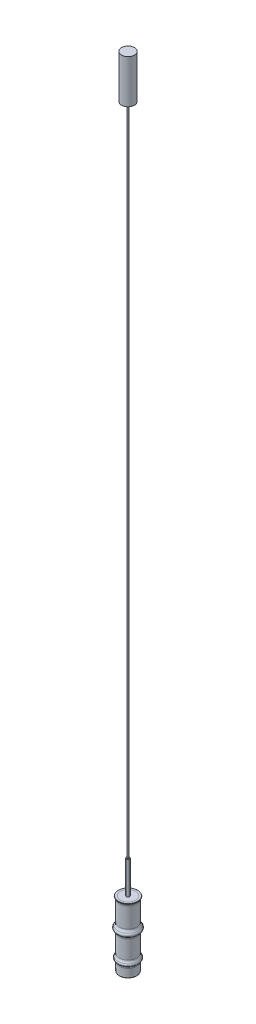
SolidWorks part; units mm, degrees
ref_plane "Alzado" through (0, 0, 0) normal (0, 0, 1) x (1, 0, 0)
ref_plane "Planta" through (0, 0, 0) normal (0, 1, 0) x (1, 0, 0)
ref_plane "Vista lateral" through (0, 0, 0) normal (1, 0, 0) x (0, 0, -1)
other "Centro de masa"
sketch "Croquis2" plane through (0, 0, 0) normal (0, 1, 0) x (1, 0, 0)
  circle A0 centre (0, 0) radius 125
  dimension "D1" = 250
extrude "Saliente-Extruir1" add sketch "Croquis2" along normal blind 10
sketch "Croquis5" plane through (0, 10, 0) normal (0, 1, 0) x (1, 0, 0)
  circle A0 centre (0, 0) radius 7
  dimension "D1" = 14
extrude "Saliente-Extruir3" add sketch "Croquis5" along normal blind 20 separate body
sketch "Croquis6" plane through (0, 0, 0) normal (0, 0, 1) x (1, 0, 0)
  line L0 (7, 30) -> (-7, 30) construction
  line L1 (-100, 393) -> (100, 393) construction
  line L2 (-100, 393) -> (-100, 130)
  line L3 (-100, 130) -> (100, 130) construction
  line L5 (-100, 393) -> (100, 130) construction
  line L6 (-100, 130) -> (100, 393) construction
  line L7 (390.346, 493) -> (-264.1076, 493) construction
  line L8 (0, 0) -> (0, 854.3075) construction
  line L9 (-125, 0) -> (125, 0) construction
  line L10 (259.6636, 401.5) -> (-247.4579, 401.5) construction
  line L12 (-247.4579, 121.5) -> (259.6636, 121.5) construction
  arc A0 (100, 393) -> (-100, 393) centre (0, 393) ccw
  arc A1 (100, 130) -> (-100, 130) centre (0, 130) cw
  point P0 (0, 261.5)
  dimension "D1" = 200
  dimension "D2" = 493
  dimension "D3" = 140
  dimension "D4" = 140
sweep "Barrer1" add path "Croquis6" parameters "D3"=14
sketch "Croquis3" plane through (0, 0, 0) normal (0, 0, 1) x (1, 0, 0)
  line L0 (100, 130) -> (100, 393) construction
  line L5 (140, 111.5) -> (140, 411.5) construction
  line L7 (140, 406.5) -> (140, 296.5)
  line L8 (140, 276.5) -> (140, 174)
  line L9 (140, 159) -> (140, 111.5)
  line L12 (135, 411.5) -> (135, 111.5)
  line L13 (135, 111.5) -> (140, 111.5) construction
  line L14 (135, 111.5) -> (140, 111.5)
  line L15 (135, 411.5) -> (145, 411.5)
  line L16 (135, 411.5) -> (140, 411.5) construction
  line L18 (100, 261.5) -> (305.5788, 261.5) construction
  line L20 (107, 130) -> (93, 130) construction
  line L21 (93, 393) -> (107, 393) construction
  arc A0 (140, 406.5) -> (145, 411.5) centre (140, 411.5) ccw
  arc A1 (140, 276.5) -> (140, 296.5) centre (140, 286.5) ccw
  arc A2 (140, 159) -> (140, 174) centre (140, 166.5) ccw
  point P13 (135, 261.5)
  point P21 (140, 225.25)
  dimension "D5" = 10
  dimension "D6" = 20
  dimension "D7" = 15
  dimension "D2" = 40
  dimension "D3" = 55
  dimension "D4" = 120
  dimension "D9" = 5
  dimension "D10" = 300
revolve "Revolución1" add sketch "Croquis3" angle 360 about L0
sketch "Croquis21" plane through (0, 393, 0) normal (0, -1, 0) x (-1, 0, 0)
  circle A0 centre (-100, 0) radius 30
  circle A1 centre (-100, 0) radius 7 construction
  dimension "D1" = 60
extrude "Saliente-Extruir4" add sketch "Croquis21" along normal up to surface (263 mm away) separate body
fillet "Redondeo1" radius 15 5 edges at (100, 159, -40) (100, 174, -40) (100, 276.5, -40) (100, 296.5, -40) (100, 406.5, -40)
fillet "Redondeo2" radius 1 2 edges at (100, 411.5, -45) (100, 111.5, -40)
delete or keep bodies "Sólido-Eliminar/Conservar 1" type keep bodies bodies 102 106
sketch "Croquis24" plane through (0, 411.5, 0) normal (0, 1, 0) x (1, 0, 0)
  circle A0 centre (100, 0) radius 35
extrude "Saliente-Extruir5" add sketch "Croquis24" against normal blind 3 separate body
sketch "Croquis25" plane through (0, 411.5, 0) normal (0, 1, 0) x (1, 0, 0)
  circle A0 centre (100, 0) radius 7.5
  circle A1 centre (100, 0) radius 35 construction
  dimension "D1" = 15
extrude "Saliente-Extruir6" add sketch "Croquis25" along normal blind 150 separate body
sketch "Croquis26" plane through (0, 561.5, 0) normal (0, 1, 0) x (1, 0, 0)
  circle A0 centre (100, 0) radius 3.5
  dimension "D1" = 7
extrude "Saliente-Extruir7" add sketch "Croquis26" along normal blind 3000 separate body
sketch "Croquis27" plane through (0, 3561.5, 0) normal (0, 1, 0) x (1, 0, 0)
  circle A0 centre (100, 0) radius 7.5
  dimension "D1" = 15
extrude "Saliente-Extruir8" add sketch "Croquis27" along normal blind 15 separate body
sketch "Croquis28" plane through (0, 3576.5, 0) normal (0, 1, 0) x (1, 0, 0)
  circle A0 centre (100, 0) radius 30
  circle A1 centre (100, 0) radius 7.5 construction
  dimension "D1" = 60
extrude "Saliente-Extruir9" add sketch "Croquis28" along normal blind 200 separate body
